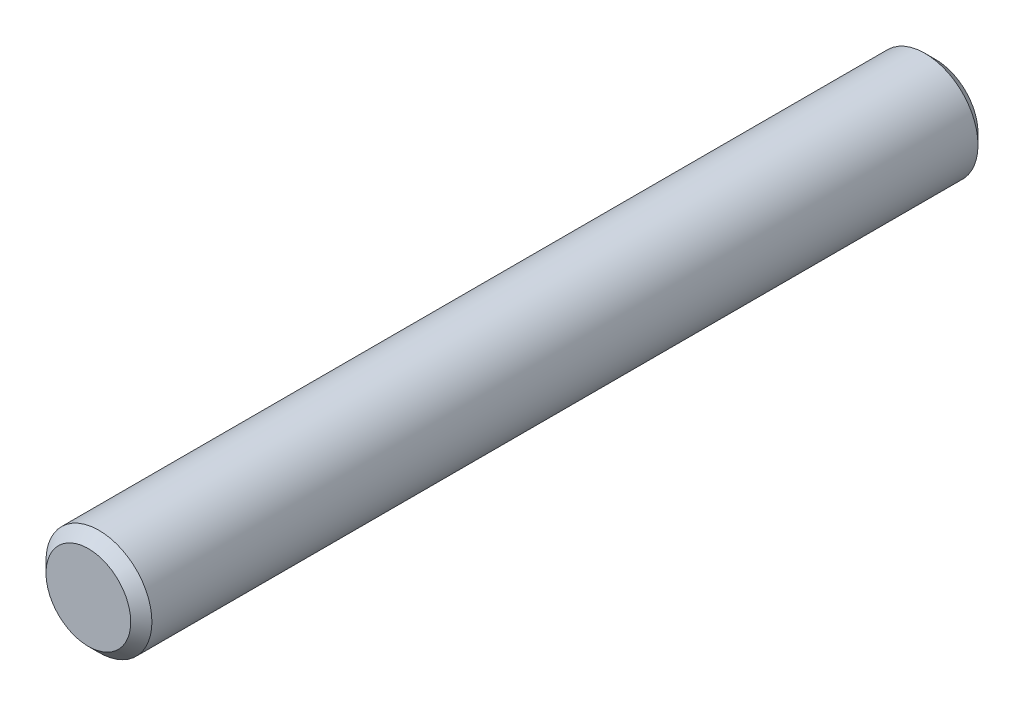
SolidWorks part; units mm, degrees
ref_plane "Frontal" through (0, 0, 0) normal (0, 0, 1) x (1, 0, 0)
ref_plane "Horizontal" through (0, 0, 0) normal (0, 1, 0) x (1, 0, 0)
ref_plane "Vertical" through (0, 0, 0) normal (1, 0, 0) x (0, 0, -1)
sketch "Esquisse1" plane through (0, 0, 0) normal (0, 0, 1) x (1, 0, 0)
  circle A0 centre (0, 0) radius 2.5
  dimension "D1" = 5
extrude "Extrusion1" add sketch "Esquisse1" along normal mid plane 40
chamfer "Chanfrein1" distance 0.5 angle 45 2 edges at (2.5, 0, -20) (2.5, 0, 20)
